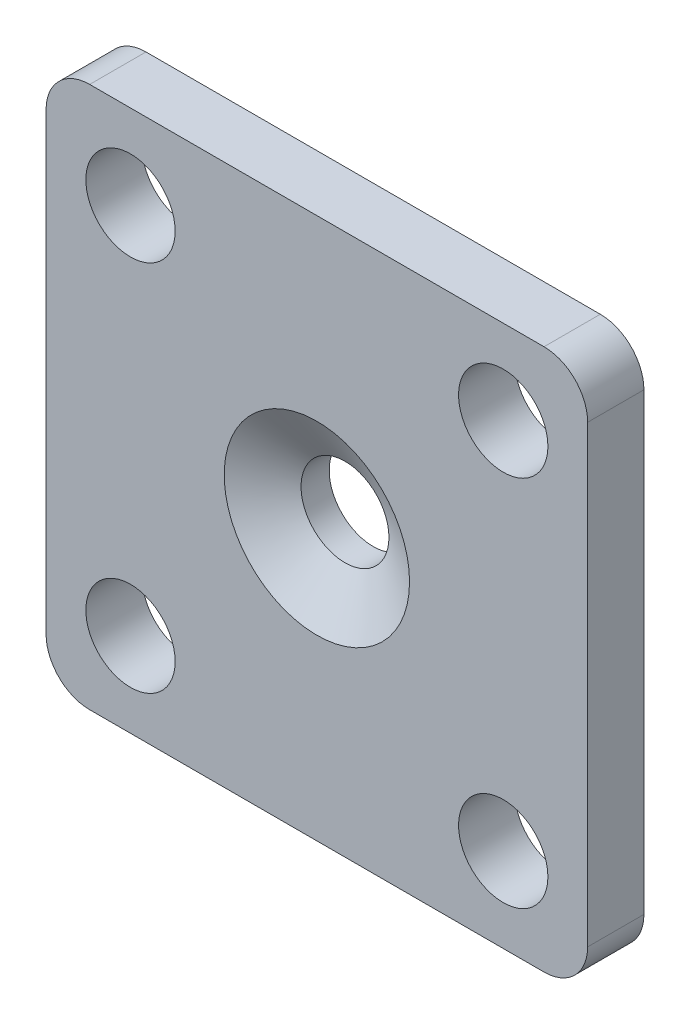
SolidWorks part; units mm, degrees
ref_plane "Front Plane" through (0, 0, 0) normal (0, 0, 1) x (1, 0, 0)
ref_plane "Top Plane" through (0, 0, 0) normal (0, 1, 0) x (1, 0, 0)
ref_plane "Right Plane" through (0, 0, 0) normal (1, 0, 0) x (0, 0, -1)
sketch "Sketch1" plane through (0, 0, 0) normal (0, 0, 1) x (1, 0, 0)
  line L1 (-4.8895, 4.8895) -> (4.8895, 4.8895)
  line L2 (-4.8895, 4.8895) -> (-4.8895, -4.8895)
  line L3 (-4.8895, -4.8895) -> (4.8895, -4.8895)
  line L4 (4.8895, 4.8895) -> (4.8895, -4.8895)
  line L5 (-4.8895, 4.8895) -> (4.8895, -4.8895) construction
  line L6 (-4.8895, -4.8895) -> (4.8895, 4.8895) construction
  line L7 (-3.3655, -3.3655) -> (3.3655, -3.3655) construction
  line L8 (-3.3655, -3.3655) -> (-3.3655, 3.3655) construction
  line L9 (-3.3655, 3.3655) -> (3.3655, 3.3655) construction
  line L10 (3.3655, -3.3655) -> (3.3655, 3.3655) construction
  line L11 (-3.3655, -3.3655) -> (3.3655, 3.3655) construction
  line L12 (-3.3655, 3.3655) -> (3.3655, -3.3655) construction
  circle A0 centre (0, 0) radius 0.7937
  circle A1 centre (-3.3655, 3.3655) radius 0.8065
  circle A2 centre (3.3655, 3.3655) radius 0.8064
  circle A3 centre (3.3655, -3.3655) radius 0.8064
  circle A4 centre (-3.3655, -3.3655) radius 0.8065
  point P0 (0, 0)
  point P6 (0, 0)
  dimension "D1" = 1.6129
  dimension "D3" = 1.5875
  dimension "D2" = 6.731
  dimension "D4" = 9.779
extrude "Boss-Extrude1" add sketch "Sketch1" along normal blind 1.016
chamfer "Chamfer1" [suppressed] distance 0.762 angle 41
chamfer "Chamfer2" distance 0.508 angle 60 1 edges at (0.7938, 0, 1.016)
sketch "Sketch2" plane through (0, 0, 0) normal (0, 0, -1) x (-1, 0, 0)
  circle A0 centre (0, 0) radius 0.9398
  circle A1 centre (0, 0) radius 1.6002
  circle A2 centre (0, 0) radius 3.1496
  circle A3 centre (0, 0) radius 3.7846
  dimension "D1" = 3.2004
  dimension "D2" = 0.6604
  dimension "D3" = 0.635
  dimension "D4" = 6.2992
extrude "Cut-Extrude1" cut sketch "Sketch2" against normal blind 0.381 contours A1 A0 | A3 A2
fillet "Fillet1" radius 0.7874 4 edges at (4.8895, -4.8895, 0.508) (-4.8895, -4.8895, 0.508) (-4.8895, 4.8895, 0.508) (4.8895, 4.8895, 0.508)
